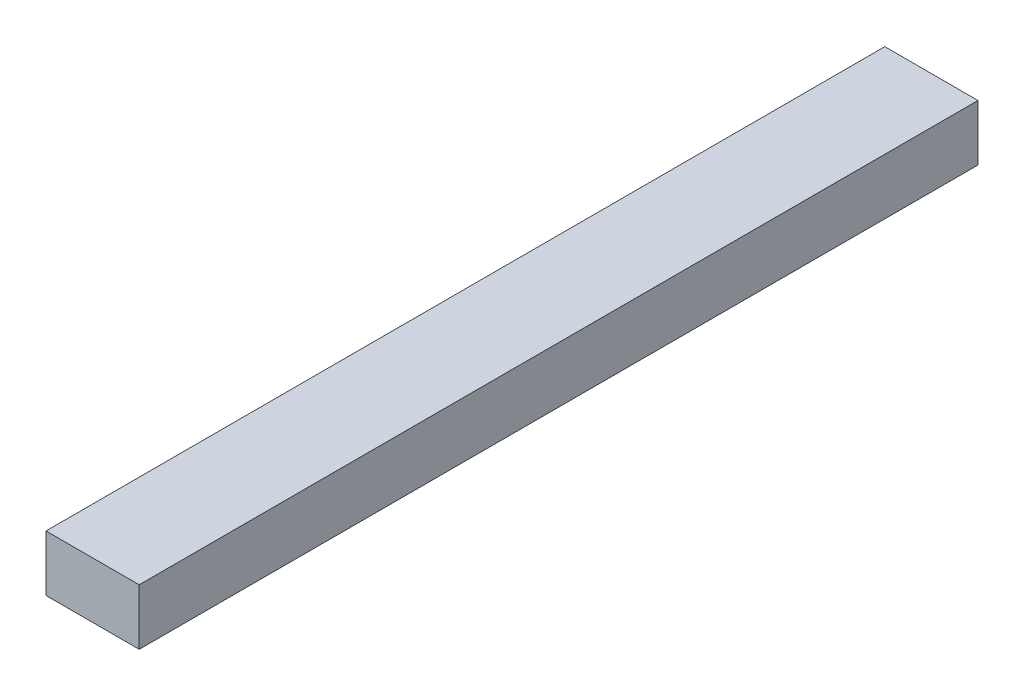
SolidWorks part; units mm, degrees
ref_plane "Front Plane" through (0, 0, 0) normal (0, 0, 1) x (1, 0, 0)
ref_plane "Top Plane" through (0, 0, 0) normal (0, 1, 0) x (1, 0, 0)
ref_plane "Right Plane" through (0, 0, 0) normal (1, 0, 0) x (0, 0, -1)
sketch "Sketch1" plane through (0, 0, 0) normal (0, 0, 1) x (1, 0, 0)
  line L1 (-2.5, -1.5) -> (2.5, -1.5)
  line L2 (-2.5, -1.5) -> (-2.5, 1.5)
  line L3 (-2.5, 1.5) -> (2.5, 1.5)
  line L4 (2.5, -1.5) -> (2.5, 1.5)
  line L5 (-2.5, -1.5) -> (2.5, 1.5) construction
  line L6 (-2.5, 1.5) -> (2.5, -1.5) construction
  point P0 (0, 0)
extrude "Boss-Extrude1" add sketch "Sketch1" along normal blind 45
